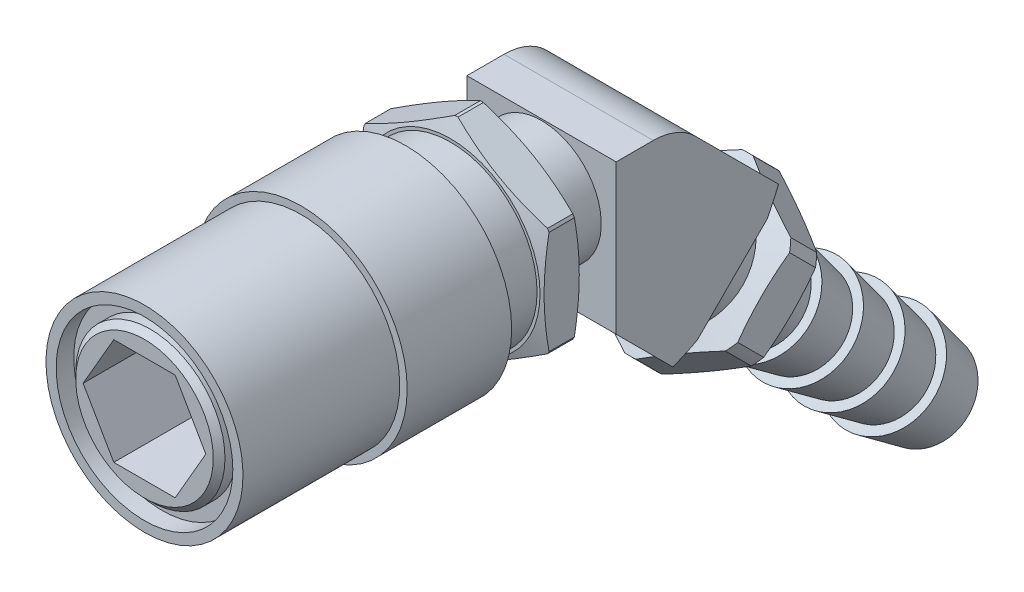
SolidWorks part; units mm, degrees
ref_plane "Front Plane" through (0, 0, 0) normal (0, 0, 1) x (1, 0, 0)
ref_plane "Top Plane" through (0, 0, 0) normal (0, 1, 0) x (1, 0, 0)
ref_plane "Right Plane" through (0, 0, 0) normal (1, 0, 0) x (0, 0, -1)
sketch "Sketch2" plane through (0, 0, 0) normal (0, 0, 1) x (1, 0, 0)
  circle A0 centre (0, 0) radius 9.017
  dimension "D1" = 18.034
extrude "Boss-Extrude1" add sketch "Sketch2" against normal blind 29.21
sketch "Sketch5" plane through (0, 0, -29.21) normal (0, 0, -1) x (-1, 0, 0)
  line L1 (-7.874, -4.5461) -> (0, -9.0921)
  line L2 (0, -9.0921) -> (7.874, -4.5461)
  line L3 (7.874, -4.5461) -> (7.874, 4.5461)
  line L4 (7.874, 4.5461) -> (0, 9.0921)
  line L5 (0, 9.0921) -> (-7.874, 4.5461)
  line L6 (-7.874, 4.5461) -> (-7.874, -4.5461)
  circle A0 centre (0, 0) radius 7.874 construction
  dimension "D1" = 15.748
extrude "Cut-Extrude1" cut sketch "Sketch5" against normal blind 3.175 flip side to cut
sketch "Sketch6" plane through (0, 0, 0) normal (1, 0, 0) x (0, 0, -1)
  line L0 (26.035, 9.016) -> (26.035, 4.6221) construction
  line L1 (26.035, 7.366) -> (22.225, 7.366)
  line L2 (26.035, 7.366) -> (26.035, 27.366)
  line L3 (26.035, 27.366) -> (22.225, 27.366)
  line L4 (22.225, 7.366) -> (22.225, 27.366)
  line L5 (0, 0) -> (29.21, 0) construction
  line L6 (29.21, -4.3939) -> (29.21, 4.3939) construction
  dimension "D1" = 14.732
  dimension "D2" = 3.81
  dimension "D3" = 20
revolve "Cut-Revolve1" cut sketch "Sketch6" angle 360 about L5
sketch "Sketch11" plane through (0, 0, 0) normal (0, 0, 1) x (1, 0, 0)
  circle A1 centre (0, 0) radius 6.35
  circle A2 centre (0, 0) radius 7.517
  circle A3 centre (0, 0) radius 7.517
  dimension "D2" = 12.7
  dimension "D1" = 1.5
extrude "Cut-Extrude3" cut sketch "Sketch11" against normal blind 1.5
sketch "Sketch12" plane through (0, 0, 0) normal (1, 0, 0) x (0, 0, -1)
  line L0 (26.035, 10.286) -> (26.035, 7.62)
  line L1 (26.035, 7.62) -> (27.0054, 10.286)
  line L2 (28.2396, 10.286) -> (29.21, 10.286)
  line L3 (26.035, 9.016) -> (26.035, 4.6221) construction
  line L4 (0, 0) -> (29.21, 0) construction
  line L5 (29.21, -4.3939) -> (29.21, 4.3939) construction
  line L11 (29.21, 7.62) -> (29.21, 10.286)
  line L12 (29.21, -7.874) -> (29.21, 7.874) construction
  line L13 (26.035, 10.286) -> (27.0054, 10.286)
  line L14 (26.035, 9.016) -> (29.21, 9.016) construction
  line L17 (28.2396, 10.286) -> (29.21, 7.62)
  dimension "D1" = 7.62
  dimension "D2" = 20
  dimension "D3" = 20
  dimension "D4" = 1.27
revolve "Cut-Revolve2" cut sketch "Sketch12" angle 360 about L4
sketch "Sketch23" plane through (0, 0, -29.21) normal (0, 0, -1) x (-1, 0, 0)
  circle A0 centre (0, 0) radius 5.08
  dimension "D1" = 10.16
extrude "Cut-Extrude7" cut sketch "Sketch23" against normal blind 6.35
sketch "Sketch27" plane through (0, 0, 0) normal (1, 0, 0) x (0, 0, -1)
  line L0 (22.225, -9.017) -> (22.225, 9.017) construction
  line L1 (0, 9.017) -> (13.335, 9.017)
  line L2 (0, 9.017) -> (0, 8.382)
  line L3 (0, 8.382) -> (13.335, 8.382)
  line L4 (13.335, 9.017) -> (13.335, 8.382)
  line L5 (0, 0) -> (22.225, 0) construction
  line L6 (22.225, -7.366) -> (22.225, 7.366) construction
  dimension "D1" = 8.89
  dimension "D2" = 16.764
revolve "Cut-Revolve5" cut sketch "Sketch27" angle 360 about L5
chamfer "Chamfer5" distance 0.381 angle 45 1 edges at (-5.08, 0, -29.21)
chamfer "Chamfer7" distance 0.5 angle 45 1 edges at (6.35, 0, 0)
sketch "Sketch13" plane through (0, 0, -29.21) normal (0, 0, -1) x (-1, 0, 0)
  circle A0 centre (0, 0) radius 5.08
  circle A1 centre (0, 0) radius 9.017 construction
  circle A2 centre (0, 0) radius 5.08 construction
extrude "Boss-Extrude3" add sketch "Sketch13" against normal blind 6.35 and the other way blind 4.572 separate body
sketch "Sketch32" plane through (0, 0, 0) normal (1, 0, 0) x (0, 0, -1)
  line L0 (33.782, 5.207) -> (33.782, -7.493)
  line L1 (33.782, -5.08) -> (33.782, 5.08) construction
  line L2 (33.782, 5.207) -> (39.0425, 5.207)
  line L3 (39.0425, 5.207) -> (48.1504, -3.9009)
  line L4 (48.1504, -3.9009) -> (39.1702, -12.8812)
  line L5 (39.1702, -12.8812) -> (33.782, -7.493)
  line L6 (33.782, 5.08) -> (22.86, 5.08) construction
  dimension "D1" = 45
  dimension "D2" = 0.127
  dimension "D3" = 12.7
  dimension "D4" = 7.62
  dimension "D5" = 16.6003
  dimension "D6" = 12.7
extrude "Boss-Extrude6" add sketch "Sketch32" along normal mid plane 12.7
fillet "Fillet1" radius 5.08 1 edges at (0, 5.207, -39.0425)
sketch "Sketch30" plane through (0, -51.5755, -0.4758) normal (0, -0.7071, -0.7071) x (1, 0, 0)
  line L0 (6.35, -54.7221) -> (6.35, -67.4221) construction
  line L1 (6.35, -67.4221) -> (-6.35, -67.4221) construction
  circle A0 centre (0, -61.0721) radius 7.0739
  point P4 (6.35, -61.0721)
  point P7 (0, -67.4221)
  dimension "D1" = 14.1478
extrude "Boss-Extrude5" add sketch "Sketch30" along normal blind 7.62
sketch "Sketch16" plane through (0, -31.4138, -31.4138) normal (0, -0.7071, -0.7071) x (1, 0, 0)
  line L1 (0, -32.2715) -> (6.35, -28.6053)
  line L2 (6.35, -28.6053) -> (6.35, -21.273)
  line L3 (6.35, -21.273) -> (0, -17.6068)
  line L4 (0, -17.6068) -> (-6.35, -21.273)
  line L5 (-6.35, -21.273) -> (-6.35, -28.6053)
  line L6 (-6.35, -28.6053) -> (0, -32.2715)
  circle A0 centre (0, -24.9391) radius 6.35 construction
  circle A1 centre (0, -24.9391) radius 7.0739 construction
  dimension "D1" = 12.7
extrude "Cut-Extrude4" cut sketch "Sketch16" against normal blind 4.572 flip side to cut
sketch "Sketch19" plane through (0, 0, 0) normal (1, 0, 0) x (0, 0, -1)
  line L0 (85.358, -50.0888) -> (51.1413, -15.8721) construction
  line L1 (49.0484, -13.7792) -> (43.6603, -8.391) construction
  line L2 (39.1702, -12.8812) -> (41.456, -10.5953) construction
  line L4 (47.2524, -4.7989) -> (51.7425, -0.3088)
  line L5 (47.2524, -4.7989) -> (49.4076, -6.9542)
  line L6 (49.4076, -6.9542) -> (53.8978, -2.4641)
  line L7 (51.7425, -0.3088) -> (53.8978, -2.4641)
  line L8 (50.8062, -5.5556) -> (48.602, -7.7599) construction
  line L9 (48.1504, -3.9009) -> (40.5304, 3.7191) construction
  dimension "D1" = 10.16
  dimension "D2" = 5.08
  dimension "D3" = 3.048
revolve "Cut-Revolve3" cut sketch "Sketch19" angle 360 about L0
sketch "Sketch31" plane through (0, 0, 0) normal (1, 0, 0) x (0, 0, -1)
  line L0 (69.0781, -33.8088) -> (98.3899, -63.1206) construction
  line L1 (49.0484, -13.7792) -> (45.8155, -10.5463) construction
  line L2 (65.9483, -24.4108) -> (52.1825, -10.6451) construction
  line L3 (51.2527, -11.5749) -> (46.8442, -15.9834) construction
  line L4 (69.0106, -28.5328) -> (65.9483, -24.4108)
  line L5 (65.9483, -24.4108) -> (65.4185, -24.9407)
  line L6 (65.4185, -24.9407) -> (62.4128, -20.8753)
  line L7 (69.0106, -28.5328) -> (54.8119, -14.3341) construction
  line L8 (62.4128, -20.8753) -> (61.8829, -21.4051)
  line L9 (61.8829, -21.4051) -> (58.8773, -17.3398)
  line L10 (58.8773, -17.3398) -> (58.3474, -17.8696)
  line L11 (58.3474, -17.8696) -> (55.3417, -13.8042)
  line L12 (55.3417, -13.8042) -> (54.8119, -14.3341)
  line L13 (54.8119, -14.3341) -> (52.1825, -10.6451)
  line L14 (52.1825, -10.6451) -> (49.0484, -13.7792)
  line L15 (49.0484, -13.7792) -> (66.4063, -31.1371)
  line L16 (66.4063, -31.1371) -> (69.0106, -28.5328)
  dimension "D1" = 8.8646
  dimension "D2" = 5
  dimension "D3" = 5
  dimension "D4" = 5
  dimension "D5" = 48.768
  dimension "D7" = 5.08
  dimension "D8" = 7.366
revolve "Revolve1" add sketch "Sketch31" angle 360 about L0
sketch "Sketch33" plane through (0, 0, 0) normal (1, 0, 0) x (0, 0, -1)
  line L0 (64.648, -29.3787) -> (66.4063, -31.1371) construction
  line L1 (43.6603, -8.391) -> (45.8155, -10.5463) construction
  line L2 (63.802, -33.7413) -> (69.0106, -28.5328) construction
  line L3 (49.4076, -6.9542) -> (51.2037, -5.1581)
  line L5 (51.2037, -5.1581) -> (51.8574, -5.8118)
  line L6 (51.8574, -5.8118) -> (49.4076, -6.9542)
  line L7 (50.8062, -5.5556) -> (48.602, -7.7599) construction
  line L8 (52.6405, -10.1871) -> (54.4366, -8.391)
  line L9 (54.0391, -8.7885) -> (51.8349, -10.9927) construction
  line L10 (54.4366, -8.391) -> (53.7829, -7.7373)
  line L11 (53.7829, -7.7373) -> (52.6405, -10.1871)
  line L12 (49.4076, -6.9542) -> (52.6405, -10.1871) construction
  line L13 (49.0484, -3.0029) -> (58.0287, 5.9774)
  line L14 (39.1702, -12.8812) -> (48.1504, -3.9009) construction
  line L15 (58.0287, 5.9774) -> (52.8439, 11.1621)
  line L16 (52.8439, 11.1621) -> (49.0484, -3.0029)
  dimension "D1" = 20
  dimension "D2" = 10.16
  dimension "D3" = 2.54
  dimension "D4" = 2.54
  dimension "D5" = 20
  dimension "D6" = 15.24
  dimension "D7" = 30
  dimension "D8" = 12.7
revolve "Cut-Revolve8" cut sketch "Sketch33" angle 360 about L0
sketch "Sketch29" plane through (0, 0, 0) normal (1, 0, 0) x (0, 0, -1)
  line L0 (0, 0) -> (39.2297, 0)
  line L2 (39.2297, 0) -> (36.9383, 3.9688)
  line L3 (13.335, 4.445) -> (0, 4.445)
  line L4 (0, 8.382) -> (0, -8.382) construction
  line L5 (0, 4.445) -> (0, 0)
  line L6 (-3.9478, 0) -> (80.7658, 0) construction
  line L7 (13.335, 4.445) -> (13.335, 3.9688)
  line L8 (13.335, 3.9688) -> (36.9383, 3.9688)
  line L9 (13.335, 9.017) -> (13.335, -9.017) construction
  line L11 (36.9383, 5.207) -> (36.9383, 3.9688) construction
  dimension "D1" = 8.89
  dimension "D2" = 60
  dimension "D3" = 7.9375
revolve "Cut-Revolve7" cut sketch "Sketch29" angle 360 about L6
sketch "Sketch28" plane through (0, 0, 0) normal (1, 0, 0) x (0, 0, -1)
  line L0 (66.4063, -31.1371) -> (32.4919, 2.7773)
  line L1 (52.2076, -16.9384) -> (55.7431, -20.4739) construction
  line L2 (32.4919, 2.7773) -> (35.3249, 3.5364)
  line L3 (35.3249, 3.5364) -> (68.2024, -29.341)
  line L4 (68.2024, -29.341) -> (66.4063, -31.1371)
  line L5 (32.4919, 2.7773) -> (105.1095, -69.8403) construction
  line L10 (63.802, -33.7413) -> (69.0106, -28.5328) construction
  dimension "D1" = 5.08
  dimension "D3" = 60
revolve "Cut-Revolve6" cut sketch "Sketch28" angle 360 about L5
sketch "Sketch34" plane through (0, 0, 0) normal (0, 0, 1) x (1, 0, 0)
  line L1 (-2.6103, 4.5212) -> (-5.2206, 0)
  line L2 (-5.2206, 0) -> (-2.6103, -4.5212)
  line L3 (-2.6103, -4.5212) -> (2.6103, -4.5212)
  line L4 (2.6103, -4.5212) -> (5.2206, 0)
  line L5 (5.2206, 0) -> (2.6103, 4.5212)
  line L6 (2.6103, 4.5212) -> (-2.6103, 4.5212)
  circle A0 centre (0, 0) radius 4.5212 construction
  dimension "D1" = 9.0424
extrude "Cut-Extrude8" cut sketch "Sketch34" against normal up to surface (13.335 mm away)
